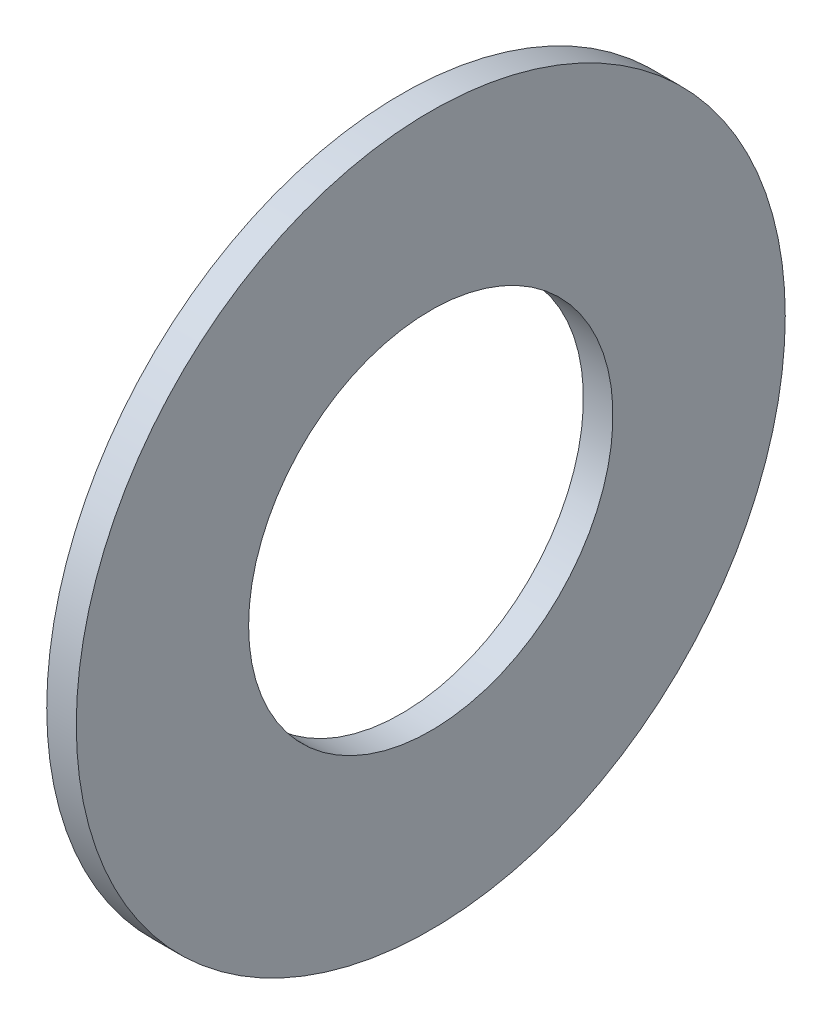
SolidWorks part; units mm, degrees
ref_plane "Plane1" through (0, 0, 0) normal (0, 0, 1) x (1, 0, 0)
ref_plane "Plane2" through (0, 0, 0) normal (0, 1, 0) x (1, 0, 0)
ref_plane "Plane3" through (0, 0, 0) normal (1, 0, 0) x (0, 0, -1)
other "Configuration Table"
sketch "Sketch1" plane through (0, 0, 0) normal (0, 0, 1) x (1, 0, 0)
  line L0 (-34.925, 0) -> (9.525, 0) construction
  line L1 (0, 18.5) -> (0, 36)
  line L2 (0, 36) -> (-3, 36)
  line L3 (-3, 36) -> (-3, 18.5)
  line L4 (-3, 18.5) -> (0, 18.5)
  dimension "Thickness" = 3
  dimension "Inside_dia" = 37
  dimension "Outside_dia" = 72
revolve "Base-Revolve" add sketch "Sketch1" angle 360 about L0
